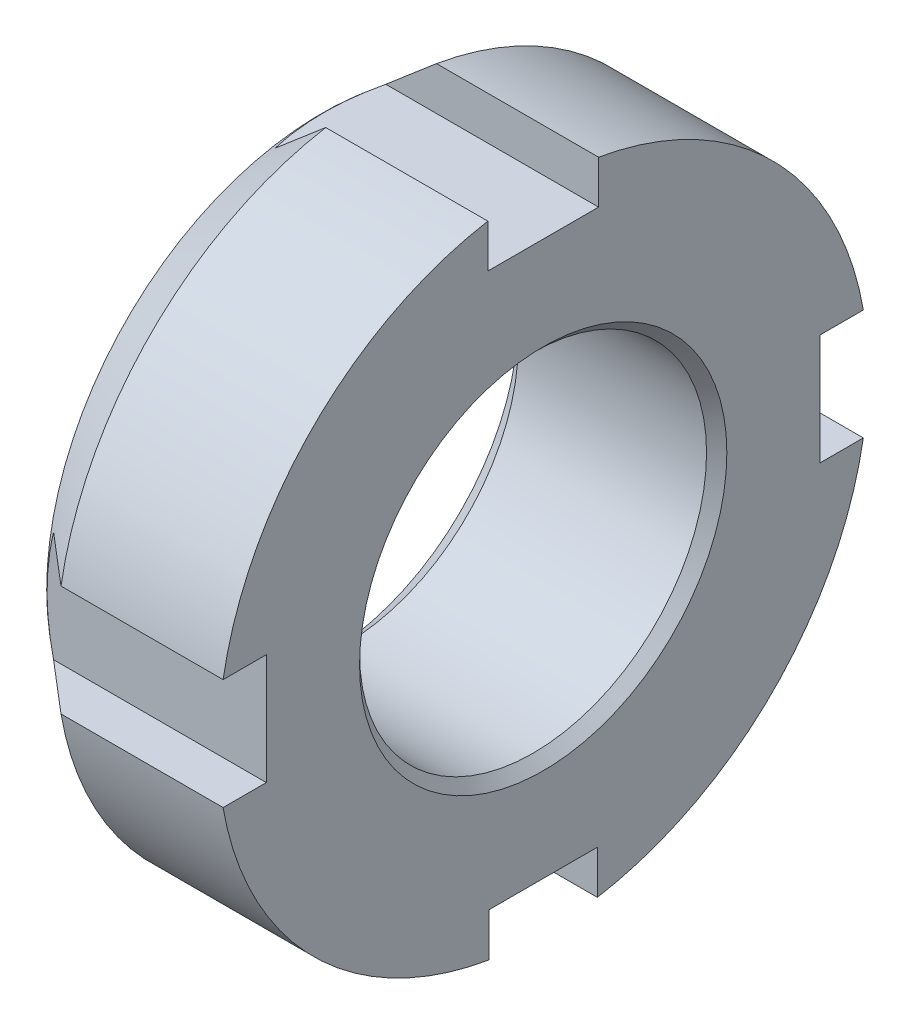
SolidWorks part; units mm, degrees
ref_plane "Front" through (0, 0, 0) normal (0, 0, 1) x (1, 0, 0)
ref_plane "Top" through (0, 0, 0) normal (0, 1, 0) x (1, 0, 0)
ref_plane "Right" through (0, 0, 0) normal (1, 0, 0) x (0, 0, -1)
sketch "Sketch1" plane through (0, 0, 0) normal (1, 0, 0) x (0, 0, -1)
  circle A0 centre (0, 0) radius 2.54
  dimension "D1" = 5.08
extrude "Place Holder" add sketch "Sketch1" along normal blind 0.254
sketch "Sketch4" plane through (0, 0, 0) normal (0, 0, 1) x (1, 0, 0)
  line L0 (0, 3.5014) -> (6.35, 3.5014)
  line L1 (3.3381, 7.3323) -> (0.6751, 7.3323)
  line L2 (0, 5.4993) -> (4.0132, 5.4993) construction
  line L3 (0, 5.4993) -> (0, 3.5014)
  line L4 (6.35, 5.1462) -> (6.35, 3.5014)
  line L5 (0, 3.5014) -> (0, 0) construction
  line L6 (3.9187, 6.2239) -> (5.6542, 5.9572)
  line L7 (0, 0) -> (14.2149, 0) construction
  arc A0 (0.6751, 7.3323) -> (0, 5.4993) centre (2.8263, 5.4993) ccw
  arc A1 (3.9187, 6.2239) -> (3.3381, 7.3323) centre (1.1869, 5.4993) ccw
  arc A2 (6.35, 5.1462) -> (5.6542, 5.9572) centre (5.5296, 5.1462) ccw
revolve "Revolve2" [suppressed] add sketch "Sketch4" angle 360 about L7
sketch "Sketch5" [suppressed] plane through (0, 0, 0) normal (-1, 0, 0) x (0, 0, 1)
  line L1 (0, 7.3323) -> (-6.35, 3.6662)
  line L2 (-6.35, 3.6662) -> (-6.35, -3.6662)
  line L3 (-6.35, -3.6662) -> (0, -7.3323)
  line L4 (0, -7.3323) -> (6.35, -3.6662)
  line L5 (6.35, -3.6662) -> (6.35, 3.6662)
  line L6 (6.35, 3.6662) -> (0, 7.3323)
  circle A0 centre (0, 0) radius 6.35 construction
  circle A1 centre (0, 0) radius 8.9002
extrude "Cut-Extrude2" [suppressed] cut sketch "Sketch5" against normal through all
sketch "Sketch6" plane through (0, 0, 0) normal (0, 0, 1) x (1, 0, 0)
  line L0 (0, 9.4615) -> (2.0433, 11.176)
  line L1 (2.0433, 11.176) -> (7.62, 11.176)
  line L2 (7.62, 11.176) -> (7.62, 6.3182)
  line L3 (0, 9.4615) -> (0, 6.7628)
  line L4 (0.7938, 5.969) -> (7.2708, 5.969)
  line L5 (7.2708, 5.969) -> (7.62, 6.3182)
  line L6 (0, 0) -> (29.1096, 0) construction
  line L7 (0.7938, 5.969) -> (0, 6.7628)
  line L8 (0, 6.7628) -> (0, 0) construction
  dimension "D1" = 225
  dimension "OD" = 22.352
  dimension "ID" = 11.938
  dimension "Width" = 7.62
  dimension "D2" = 225
  dimension "D3" = 130
  dimension "D4" = 6.477
revolve "Revolve3" add sketch "Sketch6" angle 360 about L6
sketch "Sketch7" plane through (7.62, 0, 0) normal (1, 0, 0) x (0, 0, -1)
  line L0 (0, 0) -> (0, 11.4545) construction
  line L3 (-9.525, 1.905) -> (-9.525, -1.905)
  line L4 (9.525, 1.905) -> (9.525, -1.905)
  line L5 (0, 0) -> (-12.263, 0) construction
  line L6 (-11.0124, 1.905) -> (-9.525, 1.905)
  line L7 (-11.0124, -1.905) -> (-9.525, -1.905)
  line L8 (-1.905, 11.0124) -> (-1.905, 9.525)
  line L9 (1.905, 11.0124) -> (1.905, 9.525)
  line L10 (-1.905, 9.525) -> (1.905, 9.525)
  line L13 (9.525, -1.905) -> (11.0124, -1.905)
  line L14 (9.525, 1.905) -> (11.0124, 1.905)
  line L15 (-1.8627, -9.525) -> (1.8627, -9.525)
  line L16 (-1.8627, -9.525) -> (-1.8627, -11.0197)
  line L17 (1.8627, -9.525) -> (1.8627, -11.0197)
  arc A0 (1.905, 11.0124) -> (-1.905, 11.0124) centre (0, 0) ccw
  arc A1 (11.0124, -1.905) -> (11.0124, 1.905) centre (0, 0) ccw
  arc A2 (-1.8627, -11.0197) -> (1.8627, -11.0197) centre (0, 0) ccw
  arc A3 (-11.0124, 1.905) -> (-11.0124, -1.905) centre (0, 0) ccw
  dimension "D1" = 11.176
  dimension "D2" = 9.525
  dimension "D3" = 19.05
  dimension "D4" = 9.525
  dimension "D5" = 3.81
  dimension "D6" = 3.81
  dimension "D7" = 1.905
  dimension "D8" = 1.905
  dimension "KID" = 19.05
extrude "Cut-Extrude3" cut sketch "Sketch7" against normal through all
equation "\"D6@Sketch7\"=\"D5@Sketch7\""
equation "\"D8@Sketch7\"=.5*\"D5@Sketch7\""
equation "\"D7@Sketch7\" = .5*\"D5@Sketch7\""
equation "\"D3@Sketch7\" = \"KID@Sketch7\""
equation "\"D2@Sketch7\"=.5*\"KID@Sketch7\""
equation "\"D4@Sketch7\" = .5*\"KID@Sketch7\""
equation "\"D1@Sketch7\" = .5*\"OD@Sketch6\""
equation "\"D4@Sketch6\"=.85*\"Width@Sketch6\""
